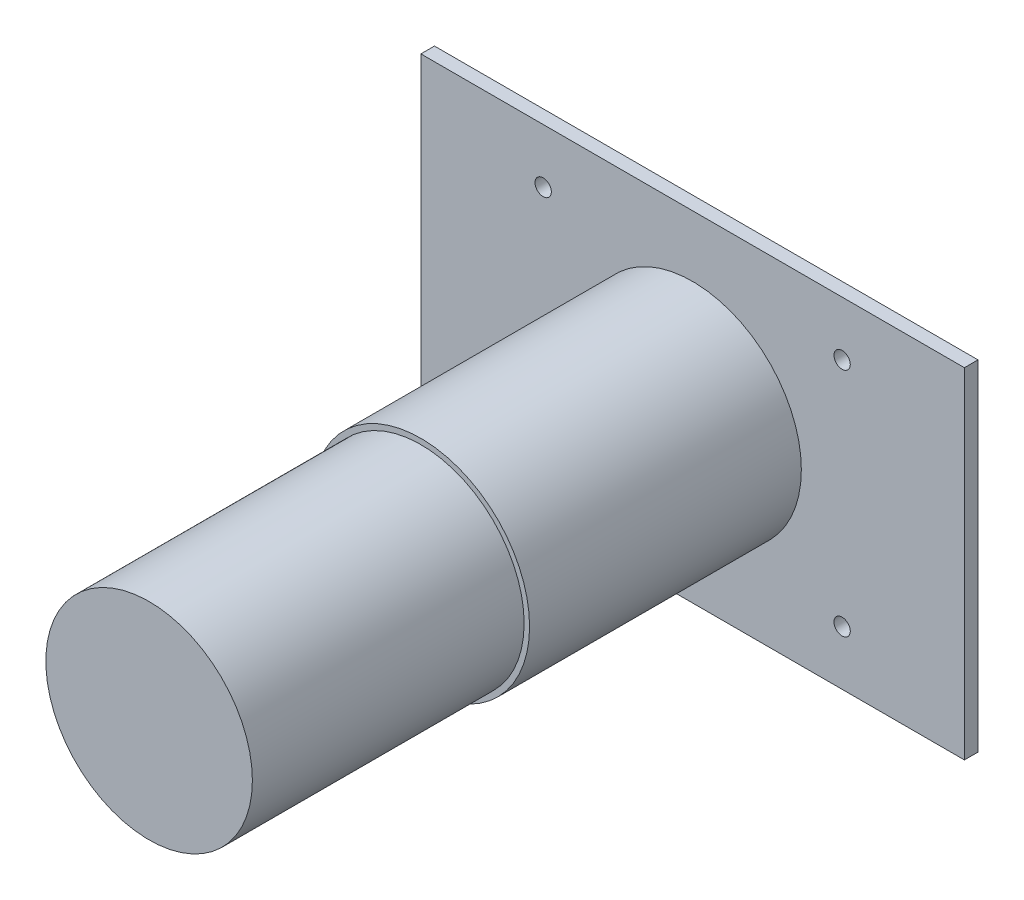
SolidWorks part; units mm, degrees
ref_plane "Plan de face" through (0, 0, 0) normal (0, 0, 1) x (1, 0, 0)
ref_plane "Plan de dessus" through (0, 0, 0) normal (0, 1, 0) x (1, 0, 0)
ref_plane "Plan de droite" through (0, 0, 0) normal (1, 0, 0) x (0, 0, -1)
sketch "Esquisse1" plane through (0, 0, 0) normal (0, 0, 1) x (1, 0, 0)
  line L1 (-102.6405, 56.7181) -> (97.3595, 56.7181)
  line L2 (-102.6405, 56.7181) -> (-102.6405, -68.2819)
  line L3 (-102.6405, -68.2819) -> (97.3595, -68.2819)
  line L4 (97.3595, 56.7181) -> (97.3595, -68.2819)
  dimension "D1" = 125
  dimension "D2" = 200
extrude "Boss.-Extru.1" add sketch "Esquisse1" along normal blind 5
sketch "Esquisse2" plane through (0, 0, 5) normal (0, 0, 1) x (1, 0, 0)
  circle A1 centre (-2.6405, -5.7819) radius 40
  circle A2 centre (-2.6405, -5.7819) radius 36
extrude "Boss.-Extru.2" add sketch "Esquisse2" along normal blind 200
sketch "Esquisse3" plane through (0, 0, 205) normal (0, 0, 1) x (1, 0, 0)
  circle A0 centre (-2.6405, -5.7819) radius 38
  circle A1 centre (-2.6405, -5.7819) radius 40
extrude "Enlèv. mat.-Extru.1" cut sketch "Esquisse3" against normal blind 100
sketch "Esquisse4" plane through (0, 0, 205) normal (0, 0, 1) x (1, 0, 0)
  circle A0 centre (-2.6405, -5.7819) radius 36
extrude "Boss.-Extru.3" add sketch "Esquisse4" against normal blind 5
sketch "Esquisse5" plane through (0, 0, 5) normal (0, 0, 1) x (1, 0, 0)
  line L0 (-102.6405, -68.2819) -> (97.3595, -68.2819) construction
  line L1 (-102.6405, 56.7181) -> (-102.6405, -68.2819) construction
  circle A0 centre (-57.6405, -48.2819) radius 3
  dimension "D3" = 6
  dimension "D1" = 20
  dimension "D2" = 45
extrude "Enlèv. mat.-Extru.2" cut sketch "Esquisse5" against normal blind 5
ref_plane "Plan1" through (0, -5.7819, 0) normal (0, -1, 0) x (-1, 0, 0)
ref_plane "Plan2" through (-2.6405, 0, 0) normal (1, 0, 0) x (0, 0, -1)
mirror "Symétrie1" about plane through (0, -5.7819, 0) normal (0, -1, 0) of "Enlèv. mat.-Extru.2"
mirror "Symétrie2" about plane through (-2.6405, 0, 0) normal (1, 0, 0) of "Symétrie1", "Enlèv. mat.-Extru.2"
